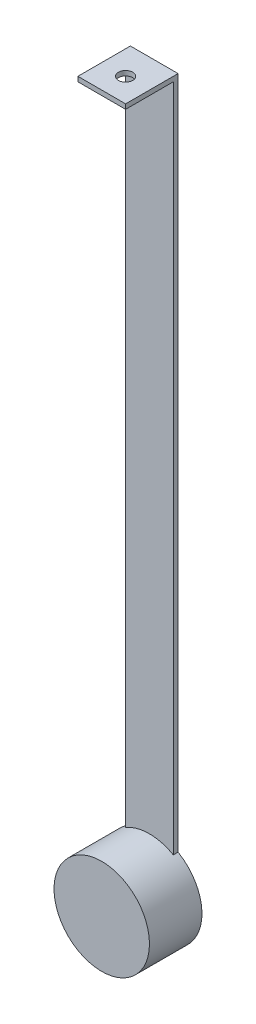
SolidWorks part; units mm, degrees
ref_plane "Front" through (0, 0, 0) normal (0, 0, 1) x (1, 0, 0)
ref_plane "Top" through (0, 0, 0) normal (0, 1, 0) x (1, 0, 0)
ref_plane "Right" through (0, 0, 0) normal (1, 0, 0) x (0, 0, -1)
sketch "Sketch1" plane through (0, 0, 0) normal (0, 0, 1) x (1, 0, 0)
  circle A0 centre (0, 0) radius 10
extrude "Extrude1" add sketch "Sketch1" along normal blind 11
sketch "Sketch2" plane through (0, 0, 0) normal (0, 0, 1) x (1, 0, 0)
  line L0 (0, 10) -> (0, 150) construction
  line L1 (5, 8.6603) -> (5, 150)
  line L2 (-5, 8.6603) -> (-5, 150)
  line L3 (-5, 150) -> (5, 150)
  line L4 (5, 0) -> (5, 150) construction
  line L5 (0, 0) -> (0, 150) construction
  line L6 (-5, 0) -> (-5, 150) construction
  arc A0 (5, 8.6603) -> (-5, 8.6603) centre (0, 0) ccw
  dimension "D1" = 150
extrude "Extrude2" add sketch "Sketch2" along normal blind 1
sketch "Sketch3" plane through (0, 0, 1) normal (0, 0, 1) x (1, 0, 0)
  line L0 (-5, 150) -> (5, 150)
  line L1 (-5, 149) -> (5, 149)
  line L2 (-5, 150) -> (-5, 149)
  line L3 (5, 150) -> (5, 149)
extrude "Extrude3" add sketch "Sketch3" along normal blind 10
sketch "Sketch4" plane through (0, 150, 0) normal (0, 1, 0) x (-1, 0, 0)
  line L0 (-5, 11) -> (5, 11) construction
  circle A0 centre (0, 6) radius 1.5
  dimension "D1" = 5
extrude "Cut-Extrude1" cut sketch "Sketch4" against normal blind 1
